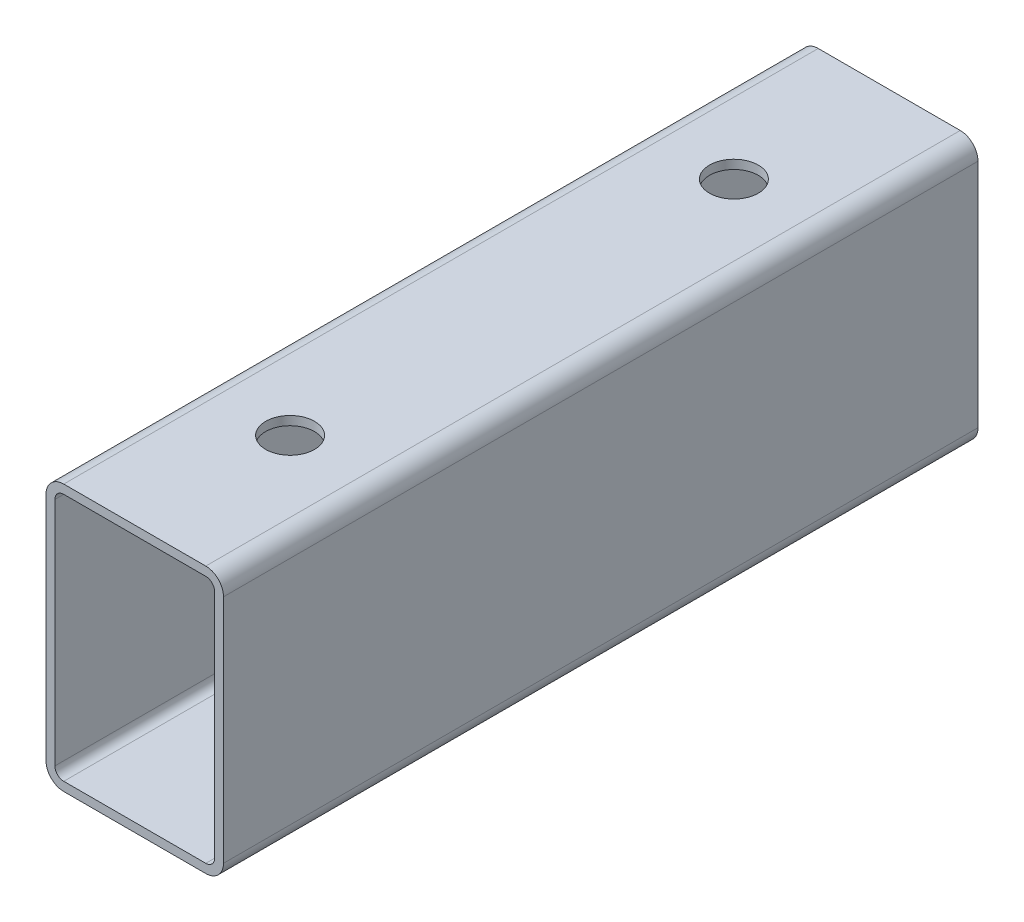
SolidWorks part; units mm, degrees
ref_plane "Plan1" through (0, 0, 0) normal (0, 0, 1) x (1, 0, 0)
ref_plane "Plan2" through (0, 0, 0) normal (0, 1, 0) x (1, 0, 0)
ref_plane "Plan3" through (0, 0, 0) normal (1, 0, 0) x (0, 0, -1)
sketch "Esquisse2" plane through (0, 0, 0) normal (0, 0, 1) x (1, 0, 0)
  line L0 (0, 3.155) -> (0, -3.155) construction
  line L1 (16, 30) -> (-16, 30)
  line L2 (20, 26) -> (20, -26)
  line L3 (16, -30) -> (-16, -30)
  line L4 (-20, 26) -> (-20, -26)
  line L5 (-4.2635, 0) -> (4.2635, 0) construction
  arc A0 (16, -30) -> (20, -26) centre (16, -26) ccw
  arc A1 (-20, -26) -> (-16, -30) centre (-16, -26) ccw
  arc A2 (-20, 26) -> (-16, 30) centre (-16, 26) cw
  arc A3 (20, 26) -> (16, 30) centre (16, 26) ccw
  dimension "D1" = 4
  dimension "D2" = 60
  dimension "D3" = 40
extrude "Base-Extru.-Mince" add sketch "Esquisse2" along normal mid plane 170 thin
sketch "Esquisse3" plane through (0, 0, 0) normal (1, 0, 0) x (0, 0, -1)
  line L0 (50, 37.6443) -> (50, -45.2532) construction
  line L1 (-85, 30) -> (85, 30) construction
  line L2 (50, 30) -> (55.5, 30)
  line L3 (50, 30) -> (50, -30)
  line L4 (50, -30) -> (55.5, -30)
  line L5 (55.5, 30) -> (55.5, -30)
  line L6 (-85, -30) -> (85, -30) construction
  dimension "D1" = 50
  dimension "D2" = 11
revolve "Enlèvement de matière-Révolution1" cut sketch "Esquisse3" angle 360 about L0
pattern_linear "Répétition linéaire1" count 2 spacing 100
